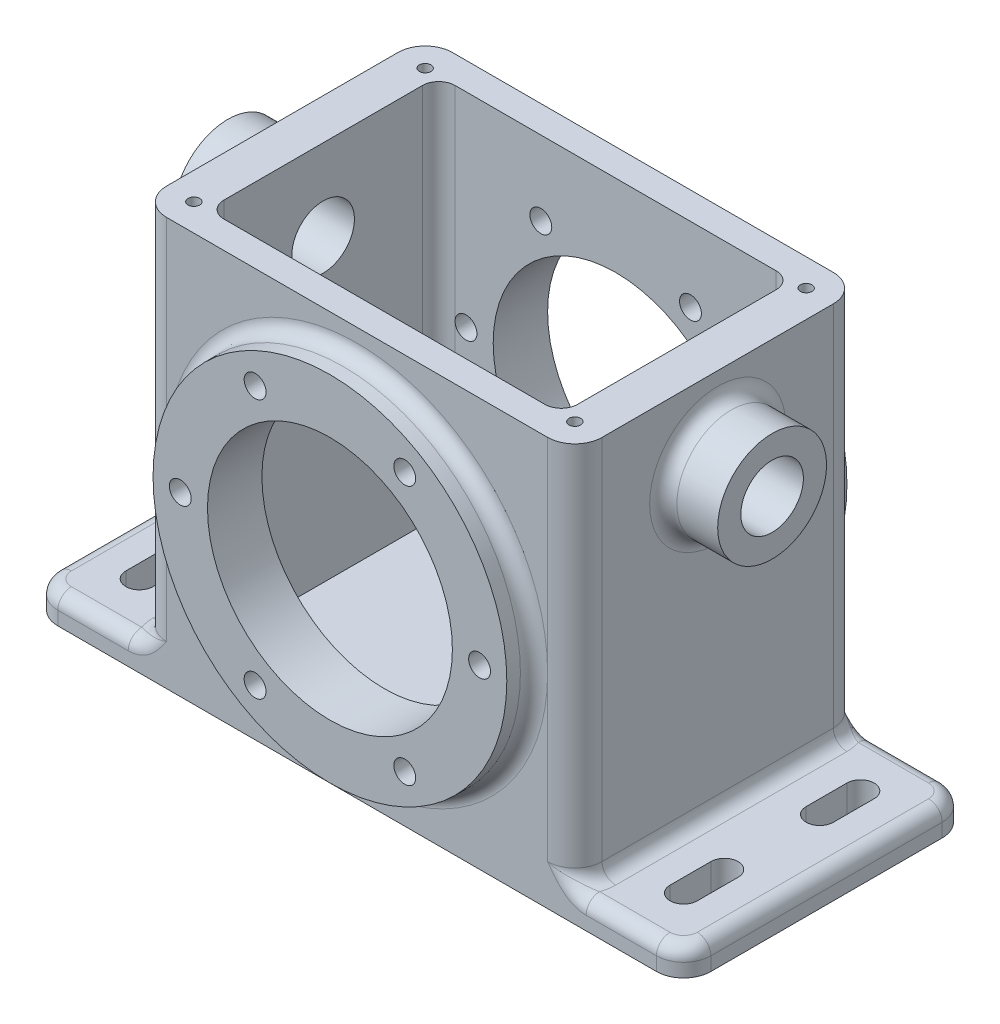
SolidWorks part; units mm, degrees
ref_plane "Front Plane" through (0, 0, 0) normal (0, 0, 1) x (1, 0, 0)
ref_plane "Top Plane" through (0, 0, 0) normal (0, 1, 0) x (1, 0, 0)
ref_plane "Right Plane" through (0, 0, 0) normal (1, 0, 0) x (0, 0, -1)
sketch "Sketch1" plane through (0, 0, 0) normal (0, 1, 0) x (1, 0, 0)
  line L0 (-76.2, 33.3375) -> (76.2, -33.3375) construction
  line L2 (-76.2, 33.3375) -> (76.2, 33.3375)
  line L3 (-76.2, 33.3375) -> (-76.2, -33.3375)
  line L4 (-76.2, -33.3375) -> (76.2, -33.3375)
  line L5 (76.2, 33.3375) -> (76.2, -33.3375)
  dimension "D1" = 66.675
  dimension "D2" = 152.4
extrude "Boss-Extrude1" add sketch "Sketch1" along normal blind 6.35
sketch "Sketch2" plane through (0, 6.35, 0) normal (0, 1, 0) x (1, 0, 0)
  line L0 (76.2, 33.3375) -> (-76.2, 33.3375) construction
  line L1 (-50.8, -33.3375) -> (50.8, -33.3375)
  line L2 (-50.8, -33.3375) -> (-50.8, 33.3375)
  line L3 (-50.8, 33.3375) -> (50.8, 33.3375)
  line L4 (50.8, -33.3375) -> (50.8, 33.3375)
  line L5 (-50.8, -33.3375) -> (50.8, 33.3375) construction
  line L6 (-50.8, 33.3375) -> (50.8, -33.3375) construction
  point P0 (0, 0)
  dimension "D1" = 101.6
extrude "Boss-Extrude2" add sketch "Sketch2" along normal blind 88.9
fillet "Fillet1" radius 6.35 8 edges at (-76.2, 3.175, -33.3375) (76.2, 3.175, -33.3375) (76.2, 3.175, 33.3375) (-76.2, 3.175, 33.3375)
fillet "Fillet2" radius 3.175 16 edges at (74.3401, 6.35, 31.4776) (48.9401, 6.35, 31.4776) (48.9401, 6.35, -31.4776) (74.3401, 6.35, -31.4776) (76.2, 6.35, 0) (-48.9401, 6.35, -31.4776) (-48.9401, 6.35, 31.4776) (-74.3401, 6.35, 31.4776) (-76.2, 6.35, 0) (-74.3401, 6.35, -31.4776)
sketch "Sketch3" plane through (0, 95.25, 0) normal (0, 1, 0) x (1, 0, 0)
  line L1 (-37.465, 26.9875) -> (37.465, 26.9875)
  line L2 (-41.275, 23.1775) -> (-41.275, -23.1775)
  line L3 (-37.465, -26.9875) -> (37.465, -26.9875)
  line L4 (41.275, 23.1775) -> (41.275, -23.1775)
  line L5 (50.8, -26.9875) -> (50.8, 26.9875) construction
  line L6 (44.45, 33.3375) -> (-44.45, 33.3375) construction
  line L7 (-44.45, -33.3375) -> (44.45, -33.3375) construction
  line L8 (-50.8, 26.9875) -> (-50.8, -26.9875) construction
  arc A0 (37.465, -26.9875) -> (41.275, -23.1775) centre (37.465, -23.1775) ccw
  arc A1 (37.465, 26.9875) -> (41.275, 23.1775) centre (37.465, 23.1775) cw
  arc A2 (-37.465, 26.9875) -> (-41.275, 23.1775) centre (-37.465, 23.1775) ccw
  arc A3 (-41.275, -23.1775) -> (-37.465, -26.9875) centre (-37.465, -23.1775) ccw
  dimension "D5" = 3.81
  dimension "D1" = 9.525
  dimension "D2" = 6.35
  dimension "D3" = 6.35
  dimension "D4" = 9.525
extrude "Top Cut" cut sketch "Sketch3" against normal blind 88.9
sketch "Sketch4" plane through (0, 0, 33.3375) normal (0, 0, 1) x (1, 0, 0)
  line L0 (-44.45, 95.25) -> (44.45, 95.25) construction
  circle A0 centre (0, 47.625) radius 41.275
  dimension "D2" = 82.55
  dimension "D1" = 47.625
extrude "Front Boss" add sketch "Sketch4" along normal blind 6.35
mirror "Mirror1" about plane through (0, 0, 0) normal (0, 0, 1) of "Front Boss"
sketch "Sketch5" plane through (50.8, 0, 0) normal (1, 0, 0) x (0, 0, -1)
  line L0 (-26.9875, 95.25) -> (26.9875, 95.25) construction
  circle A0 centre (0, 76.2) radius 12.7
  dimension "D2" = 25.4
  dimension "D1" = 19.05
extrude "Side Boss" add sketch "Sketch5" along normal blind 12.7
mirror "Mirror2" about plane through (0, 0, 0) normal (1, 0, 0) of "Side Boss"
sketch "Sketch6" plane through (0, 0, 39.6875) normal (0, 0, 1) x (1, 0, 0)
  circle A0 centre (0, 47.625) radius 28.575
  circle A2 centre (0, 47.625) radius 41.275 construction
  dimension "D1" = 57.15
extrude "Cut-Extrude2" cut sketch "Sketch6" against normal through all
sketch "Sketch7" plane through (63.5, 0, 0) normal (1, 0, 0) x (0, 0, -1)
  circle A0 centre (0, 76.2) radius 7.3025
  dimension "D1" = 14.605
extrude "Shaft Hole" cut sketch "Sketch7" against normal through all
hole_wizard "1/4-20 Tapped Hole1" positions "Sketch9" profile "Sketch8" tap size "1/4-20" standard "ANSI Inch"
sketch "Sketch9" plane through (0, 0, 39.6875) normal (0, 0, 1) x (1, 0, 0)
  line L0 (41.275, 47.625) -> (28.575, 47.625) construction
  circle A0 centre (0, 47.625) radius 41.275 construction
  circle A1 centre (0, 47.625) radius 41.275 construction
  circle A2 centre (0, 47.625) radius 28.575 construction
  point P12 (34.925, 47.625)
sketch "Sketch8" plane through (34.925, 47.625, 39.6875) normal (1, 0, 0) x (0, -1, 0)
  line L0 (0, 0) -> (0, 12.7)
  line L1 (0, 12.7) -> (2.5527, 12.7)
  line L2 (2.5527, 12.7) -> (2.5527, 0)
  line L5 (2.5527, 0) -> (0, 0)
  line L11 (0, -6.35) -> (0, 107.95) construction
  dimension "Thru Tap Drill Dia." = 5.1054
  dimension "Thru Tap Drill Depth" = 12.7
pattern_circular "CirPattern1" count 6 over 360 about axis through (0, 47.625, 0) along (0, 0, 1) of "1/4-20 Tapped Hole1"
mirror "Mirror3" about plane through (0, 0, 0) normal (0, 0, 1) of "CirPattern1", "1/4-20 Tapped Hole1"
hole_wizard "#6-32 Tapped Hole1" positions "Sketch12" profile "Sketch10" tap size "#6-32" standard "ANSI Inch"
sketch "Sketch12" plane through (0, 95.25, 0) normal (0, 1, 0) x (1, 0, 0)
  point P0 (-44.45, -26.9875)
  point P3 (-44.45, 26.9875)
  point P6 (44.45, 26.9875)
  point P9 (44.45, -26.9875)
sketch "Sketch10" plane through (-44.45, 95.25, 26.9875) normal (1, 0, 0) x (0, 0, 1)
  line L0 (0, 0) -> (0, 11.7855)
  line L1 (0, 11.7855) -> (1.3525, 10.9728)
  line L2 (1.3525, 10.9728) -> (1.3525, 0)
  line L5 (1.3525, 0) -> (0, 0)
  line L10 (0, 11.7855) -> (-1.3525, 10.9728) construction
  line L11 (0, -6.35) -> (0, 107.95) construction
  dimension "Tap Drill Dia." = 2.7051
  dimension "Tap Drill Depth" = 10.9728
  dimension "Drill Angle" = 118
sketch "Sketch13" plane through (0, 6.35, 0) normal (0, 1, 0) x (1, 0, 0)
  line L0 (-63.5, -20.6375) -> (-63.5, -11.1125) construction
  line L1 (-66.675, -20.6375) -> (-66.675, -11.1125)
  line L2 (-60.325, -20.6375) -> (-60.325, -11.1125)
  line L3 (-76.2, -26.9875) -> (-76.2, 26.9875) construction
  line L4 (-53.4303, -33.3375) -> (-69.85, -33.3375) construction
  arc A0 (-66.675, -20.6375) -> (-60.325, -20.6375) centre (-63.5, -20.6375) ccw
  arc A1 (-60.325, -11.1125) -> (-66.675, -11.1125) centre (-63.5, -11.1125) ccw
  point P2 (-63.5, -15.875)
  dimension "D4" = 12.7
  dimension "D1" = 6.35
  dimension "D2" = 9.525
  dimension "D3" = 12.7
extrude "Slot" cut sketch "Sketch13" against normal through all
pattern_linear "LPattern1" count 2 spacing 31.75 along (0, 0, -1) of "Slot"
mirror "Mirror4" about plane through (0, 0, 0) normal (1, 0, 0) of "LPattern1", "Slot"
fillet "Fillet3" radius 3.175 4 edges at (-41.275, 47.625, 33.3375) (41.275, 47.625, -33.3375) (50.8, 76.2, 12.7) (-50.8, 76.2, -12.7)
